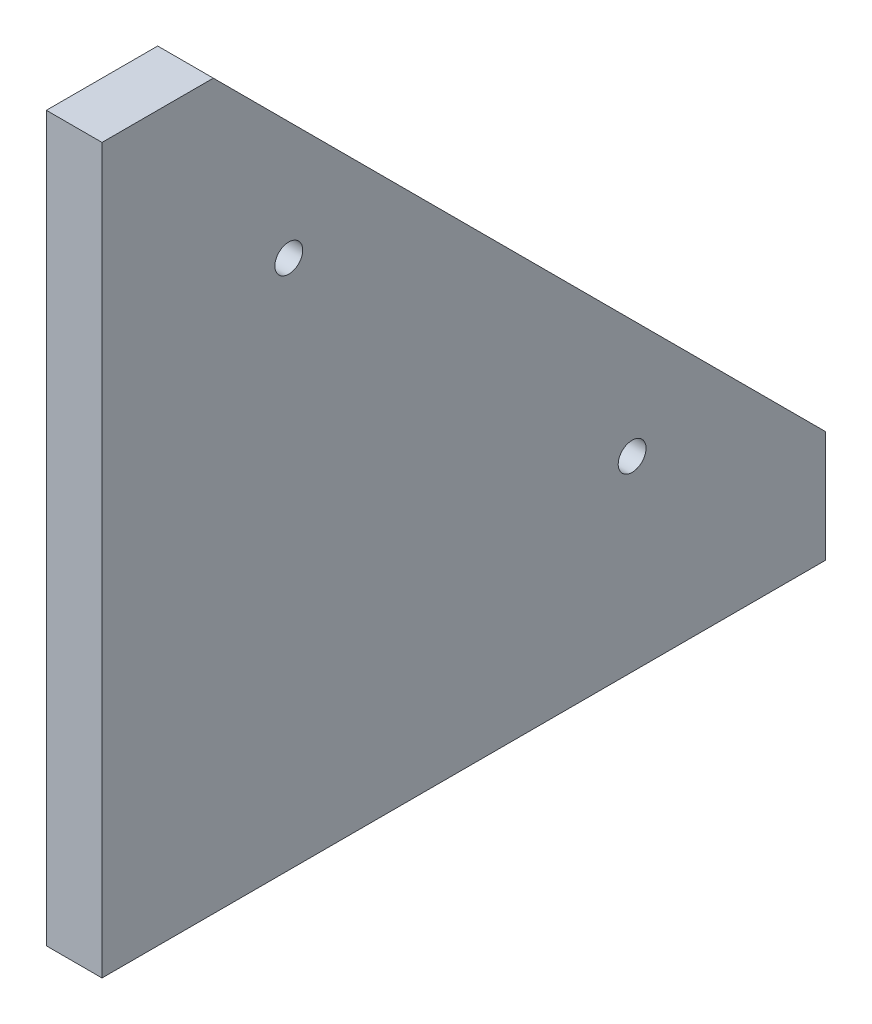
SolidWorks part; units mm, degrees
other "Connection Feature"
ref_plane "Front Plane" through (0, 0, 0) normal (0, 0, 1) x (1, 0, 0)
ref_plane "Top Plane" through (0, 0, 0) normal (0, 1, 0) x (1, 0, 0)
ref_plane "Right Plane" through (0, 0, 0) normal (1, 0, 0) x (0, 0, -1)
sketch "Sketch1" plane through (0, 0, 0) normal (1, 0, 0) x (0, 0, -1)
  line L0 (0, 65) -> (0, 0)
  line L1 (0, 0) -> (65, 0)
  line L2 (65, 0) -> (65, 10)
  line L3 (65, 10) -> (10, 65)
  line L4 (10, 65) -> (0, 65)
  line L5 (0, 0) -> (37.5, 37.5) construction
  line L6 (16.7757, 47.6177) -> (47.6177, 16.7757) construction
  point P9 (32.1967, 32.1967)
  dimension "D1" = 65
  dimension "D2" = 10
  dimension "D3" = 7.5
extrude "Boss-Extrude1" add sketch "Sketch1" along normal mid plane 5
hole_wizard "Ø2.5mm Dowel Hole1" positions "Sketch2" profile "Sketch3" hole size "Ø2.5" standard "ANSI Metric"
sketch "Sketch2" plane through (2.5, 0, 0) normal (1, 0, 0) x (0, 0, -1)
  point P0 (16.7757, 47.6177)
  point P3 (47.6177, 16.7757)
sketch "Sketch3" plane through (2.5, 47.6177, -16.7757) normal (0, 1, 0) x (0, 0, -1)
  line L0 (0, 0) -> (0, 5)
  line L1 (0, 5) -> (1.275, 5)
  line L2 (1.25, 4.975) -> (1.25, 0)
  line L5 (1.25, 0) -> (0, 0)
  line L7 (1.275, 5) -> (1.25, 4.975)
  line L8 (-1.275, 5) -> (-1.25, 4.975) construction
  line L11 (0, -6.35) -> (0, 107.95) construction
  dimension "Thru Hole Dia." = 2.5
  dimension "Thru Hole Depth" = 5
  dimension "Far C'Sink Dia." = 2.55
  dimension "Far C'Sink Angle" = 90
other "Configuration Table"
